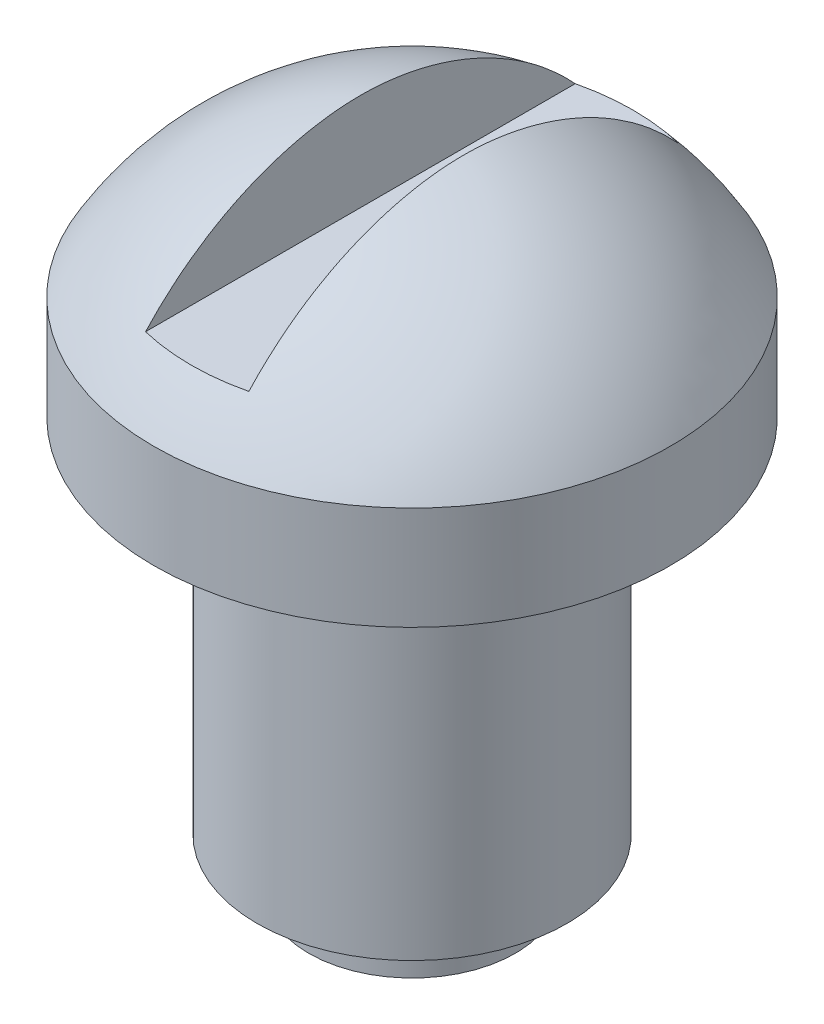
SolidWorks part; units mm, degrees
ref_plane "Front Plane" through (0, 0, 0) normal (0, 0, 1) x (1, 0, 0)
ref_plane "Top Plane" through (0, 0, 0) normal (0, 1, 0) x (1, 0, 0)
ref_plane "Right Plane" through (0, 0, 0) normal (1, 0, 0) x (0, 0, -1)
sketch "Sketch1" plane through (0, 0, 0) normal (0, 0, 1) x (1, 0, 0)
  line L0 (0, 0) -> (0, -22.8287) construction
  line L1 (0, 0) -> (2, 0)
  line L2 (2, 0) -> (2, 1)
  line L3 (2, 1) -> (3, 1)
  line L4 (3, 1) -> (3, 8)
  line L5 (3, 8) -> (5, 8)
  line L6 (5, 8) -> (5, 10)
  line L7 (0, 13) -> (0, 0)
  arc A0 (0, 13) -> (5, 10) centre (-0.198, 7.0033) cw
  dimension "D4" = 6
  dimension "D1" = 4
  dimension "D2" = 6
  dimension "D3" = 10
  dimension "D5" = 1
  dimension "D6" = 2
  dimension "D7" = 7
  dimension "D8" = 5
revolve "Revolve1" add sketch "Sketch1" angle 360 about L0
sketch "Sketch2" plane through (0, 0, 0) normal (0, 0, 1) x (1, 0, 0)
  line L1 (-1, 15.935) -> (1, 15.935)
  line L2 (-1, 15.935) -> (-1, 11)
  line L3 (-1, 11) -> (1, 11)
  line L4 (1, 15.935) -> (1, 11)
  line L5 (-1, 15.935) -> (1, 11) construction
  line L6 (-1, 11) -> (1, 15.935) construction
  point P0 (0, 13.4675)
  dimension "D1" = 2
  dimension "D2" = 2
extrude "Cut-Extrude1" cut sketch "Sketch2" against normal mid plane 10
